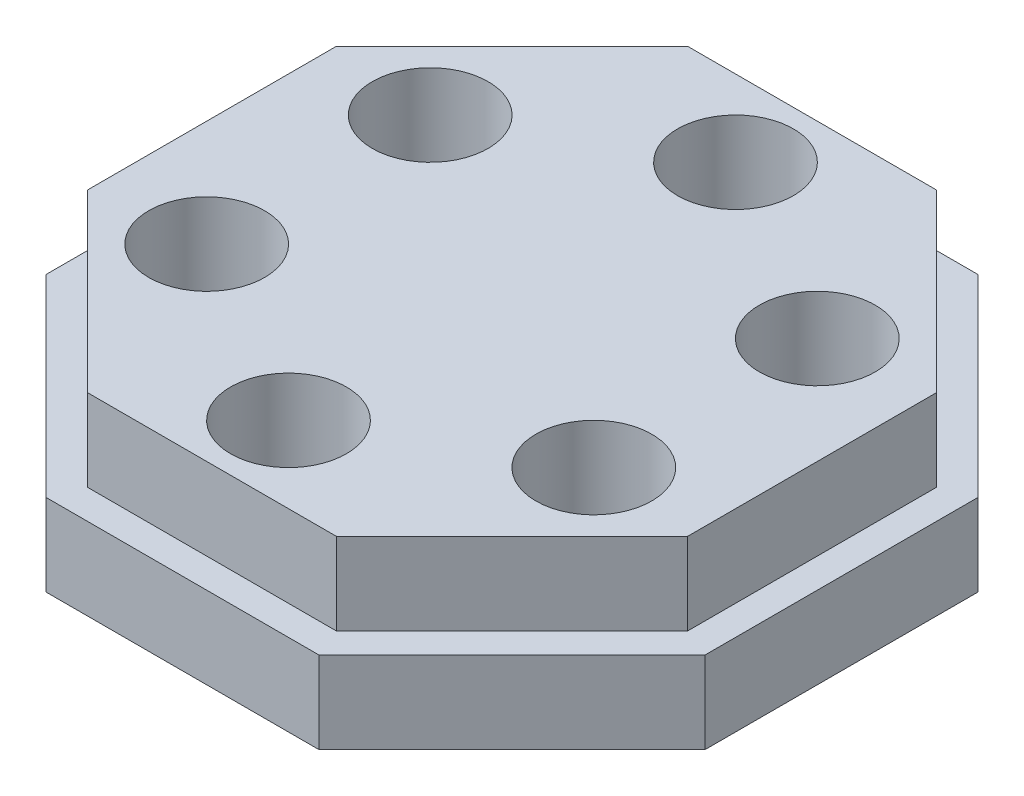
SolidWorks part; units mm, degrees
ref_plane "Front Plane" through (0, 0, 0) normal (0, 0, 1) x (1, 0, 0)
ref_plane "Top Plane" through (0, 0, 0) normal (0, 1, 0) x (1, 0, 0)
ref_plane "Right Plane" through (0, 0, 0) normal (1, 0, 0) x (0, 0, -1)
sketch "Sketch1" plane through (0, 0, 0) normal (0, 1, 0) x (1, 0, 0)
  line L0 (-31.7209, 76.581) -> (31.7209, 76.581)
  line L1 (31.7209, 76.581) -> (76.581, 31.7209)
  line L2 (76.581, 31.7209) -> (76.581, -31.7209)
  line L3 (76.581, -31.7209) -> (31.7209, -76.581)
  line L4 (31.7209, -76.581) -> (-31.7209, -76.581)
  line L5 (-31.7209, -76.581) -> (-76.581, -31.7209)
  line L6 (-76.581, -31.7209) -> (-76.581, 31.7209)
  line L7 (-76.581, 31.7209) -> (-31.7209, 76.581)
  line L8 (0, 76.581) -> (0, 0) construction
  line L9 (76.581, 0) -> (0, 0) construction
  dimension "D1" = 153.162
  dimension "D2" = 135
extrude "Boss-Extrude1" add sketch "Sketch1" along normal blind 19.05
sketch "Sketch2" plane through (0, 19.05, 0) normal (0, 1, 0) x (1, 0, 0)
  line L0 (-28.8802, 69.723) -> (28.8802, 69.723)
  line L1 (28.8802, 69.723) -> (69.723, 28.8802)
  line L2 (69.723, 28.8802) -> (69.723, -28.8802)
  line L3 (69.723, -28.8802) -> (28.8802, -69.723)
  line L4 (28.8802, -69.723) -> (-28.8802, -69.723)
  line L5 (-28.8802, -69.723) -> (-69.723, -28.8802)
  line L6 (-69.723, -28.8802) -> (-69.723, 28.8802)
  line L7 (-69.723, 28.8802) -> (-28.8802, 69.723)
  line L8 (0, 0) -> (0, -69.723) construction
  line L9 (-69.723, 0) -> (0, 0) construction
  line L12 (-31.7209, -76.581) -> (31.7209, -76.581) construction
  dimension "D1" = 135
  dimension "D2" = 146.304
extrude "Boss-Extrude2" add sketch "Sketch2" along normal blind 19.05
sketch "Sketch3" plane through (0, 38.1, 0) normal (0, 1, 0) x (1, 0, 0)
  line L0 (0, 51.943) -> (0, 0) construction
  circle A0 centre (0, 0) radius 51.943 construction
  circle A1 centre (0, 51.943) radius 13.462
  circle A2 centre (44.984, 25.9715) radius 13.462
  circle A3 centre (44.984, -25.9715) radius 13.462
  circle A4 centre (0, -51.943) radius 13.462
  circle A5 centre (-44.984, -25.9715) radius 13.462
  circle A6 centre (-44.984, 25.9715) radius 13.462
  point P18 (0, 0)
  dimension "D1" = 103.886
  dimension "D2" = 26.924
  dimension "D3" = 6
extrude "Cut-Extrude1" cut sketch "Sketch3" against normal through all
